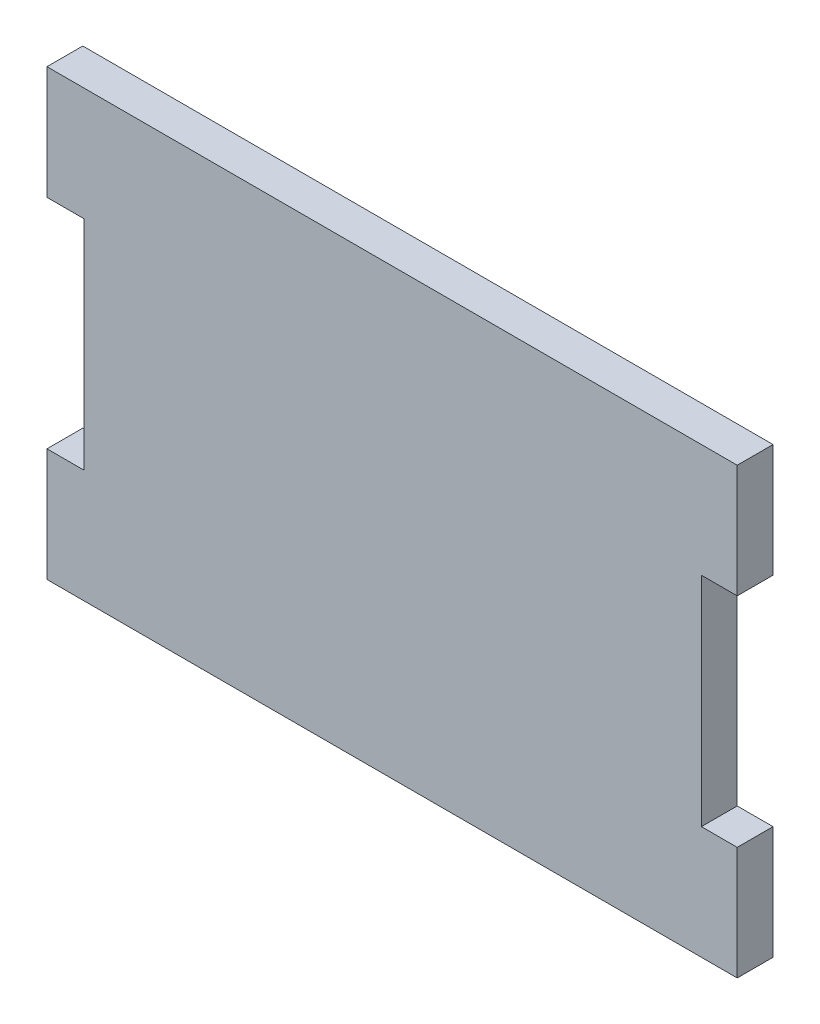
SolidWorks part; units mm, degrees
ref_plane "Front Plane" through (0, 0, 0) normal (0, 0, 1) x (1, 0, 0)
ref_plane "Top Plane" through (0, 0, 0) normal (0, 1, 0) x (1, 0, 0)
ref_plane "Right Plane" through (0, 0, 0) normal (1, 0, 0) x (0, 0, -1)
sketch "Sketch1" plane through (0, 0, 0) normal (0, 0, 1) x (1, 0, 0)
  line L0 (48.1833, 15.5) -> (48.1833, 7.6)
  line L1 (0, 15.5) -> (48.1833, 15.5)
  line L2 (0, 15.5) -> (0, 7.5)
  line L3 (0, -15.5) -> (48.1833, -15.5)
  line L10 (48.1833, -7.6) -> (48.1833, -15.5)
  line L17 (0, -7.6) -> (0, -15.5)
  line L18 (48.1833, 7.6) -> (45.6833, 7.6)
  line L20 (48.1833, -7.6) -> (45.6833, -7.6)
  line L21 (-0.1, 7.6) -> (-0.1, -7.6)
  line L22 (-0.1, -7.6) -> (2.6, -7.6)
  line L23 (2.6, -7.6) -> (2.6, 7.6)
  line L24 (2.6, 7.6) -> (-0.1, 7.6)
  line L26 (0, -7.6) -> (2.6, -7.6)
  line L27 (2.6, -7.6) -> (2.6, 7.6)
  line L28 (2.6, 7.6) -> (0, 7.6)
  line L29 (45.6833, 7.6) -> (45.6833, -7.6)
  dimension "D1" = 2.5
  dimension "D2" = 0.1
extrude "Boss-Extrude1" add sketch "Sketch1" along normal blind 2.5 contours L29 L18 L0 L1 L2 L28 L27 L26 L17 L3 L10 L20
